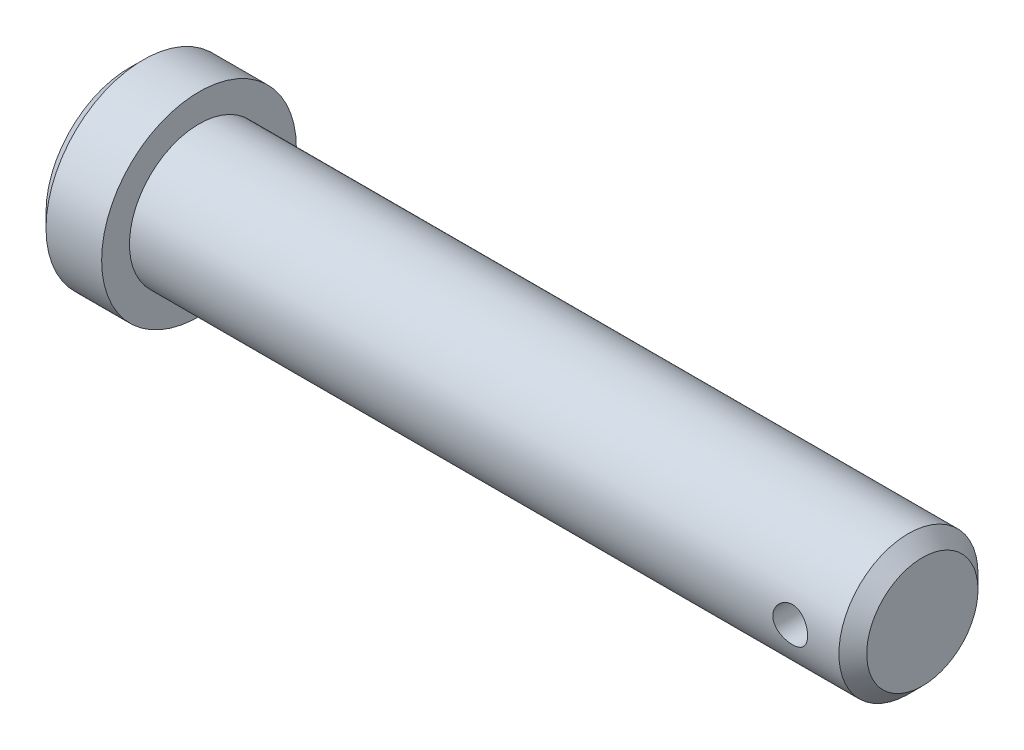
SolidWorks part; units mm, degrees
ref_plane "Спереди" through (0, 0, 0) normal (0, 0, 1) x (1, 0, 0)
ref_plane "Сверху" through (0, 0, 0) normal (0, 1, 0) x (1, 0, 0)
ref_plane "Справа" through (0, 0, 0) normal (1, 0, 0) x (0, 0, -1)
sketch "Эскиз1" plane through (0, 0, 0) normal (0, 0, 1) x (1, 0, 0)
  line L0 (0, 0) -> (0, 7)
  line L1 (0, 7) -> (5, 7)
  line L2 (5, 7) -> (5, 5)
  line L3 (5, 5) -> (57, 5)
  line L4 (57, 5) -> (57, 0)
  line L5 (57, 0) -> (0, 0)
  dimension "D1" = 57
  dimension "D2" = 7
  dimension "D3" = 5
  dimension "D4" = 5
revolve "Повернуть1" add sketch "Эскиз1" angle 360 about L5
sketch "Эскиз2" plane through (0, 0, 0) normal (0, 0, 1) x (1, 0, 0)
  line L0 (0, 0) -> (58.4826, 0) construction
  line L1 (0, 7) -> (0, -7) construction
  line L2 (5, -7) -> (5, 7) construction
  circle A1 centre (52.5, 0) radius 1.25
  dimension "D1" = 2.5
  dimension "D2" = 47.5
extrude "Вырез-Вытянуть1" cut sketch "Эскиз2" against normal through all both and the other way through all
chamfer "Фаска1" distance 1 angle 45 1 edges at (0, 0, -7)
chamfer "Фаска2" distance 1 angle 45 1 edges at (57, 0, -5)
